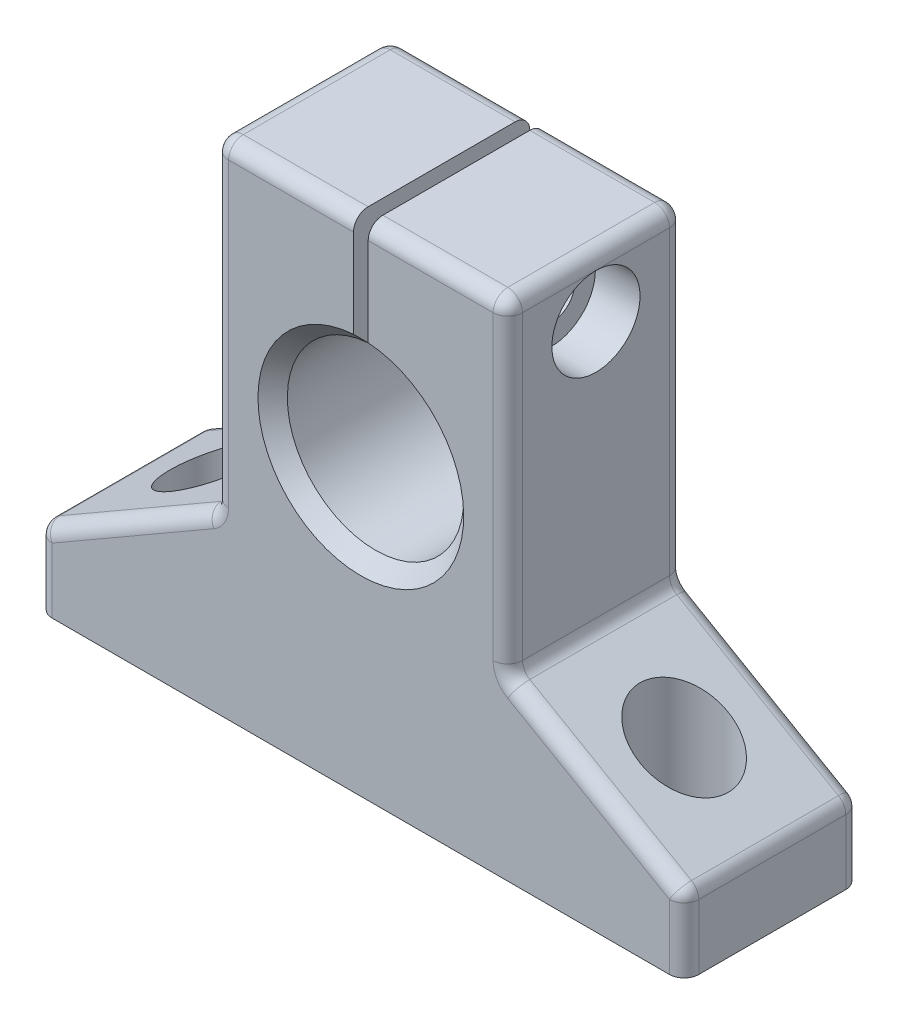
SolidWorks part; units mm, degrees
ref_plane "Front" through (0, 0, 0) normal (0, 0, 1) x (1, 0, 0)
ref_plane "Top" through (0, 0, 0) normal (0, 1, 0) x (1, 0, 0)
ref_plane "Right" through (0, 0, 0) normal (1, 0, 0) x (0, 0, -1)
sketch "Sketch1"
  dimension "D3" = 19.05
  dimension "B" = 69.85
  dimension "A" = 31.75
  dimension "D" = 53.975
  dimension "G" = 31.75
  dimension "D4" = 30
  dimension "F" = 7.9375
  dimension "Slot" = 1.5875
extrude "Extrude1" add sketch "Sketch1" along normal mid plane 19.05
sketch "Sketch2"
sketch "Sketch4"
  dimension "D1" = 50.8
ref_plane "Plane1" through (0, 13.4368, 0) normal (0, -1, 0) x (1, 0, 0)
hole_wizard "Rod Adjustment Bolt" positions "3DSketch1" profile "Sketch3" counterbore size "3/8" standard "Ansi Inch"
sketch3d "3DSketch1"
sketch "Sketch3"
  dimension "Thru Hole Dia." = 5.1054
  dimension "Thru Hole Depth" = 50.8
  dimension "C'Bore Dia." = 9.525
  dimension "C'Bore Depth" = 4.826
hole_wizard "Mounting Holes" positions "Sketch6" profile "Sketch5" counterbore size "3/8" standard "Ansi Inch"
sketch "Sketch6"
sketch "Sketch5"
  dimension "Thru Hole Dia." = 5.1054
  dimension "Thru Hole Depth" = 13.4368
  dimension "C'Bore Dia." = 9.525
  dimension "C'Bore Depth" = 9.525
fillet "Fillet1" radius 1.5875 22 edges at (34.925, 7.9375, 0) (15.875, 18.936, 0) (15.875, 53.975, 0) (-34.925, 7.9375, 0) (-15.875, 18.936, 0) (-15.875, 53.975, 0) (-25.4, 13.4368, -9.525) (25.4, 13.4368, -9.525) (25.4, 13.4368, 9.525) (-25.4, 13.4368, 9.525) (-34.925, 3.9688, 9.525) (-34.925, 3.9688, -9.525) (34.925, 3.9688, 9.525) (34.925, 3.9688, -9.525) (8.3344, 53.975, 9.525) (-8.3344, 53.975, 9.525) (8.3344, 53.975, -9.525) (-8.3344, 53.975, -9.525) (-15.875, 36.4555, -9.525) (15.875, 36.4555, -9.525) (15.875, 36.4555, 9.525) (-15.875, 36.4555, 9.525)
chamfer "Chamfer1" distance 1.5875 angle 45 2 edges at (0, 22.225, -9.525) (0, 22.225, 9.525)
